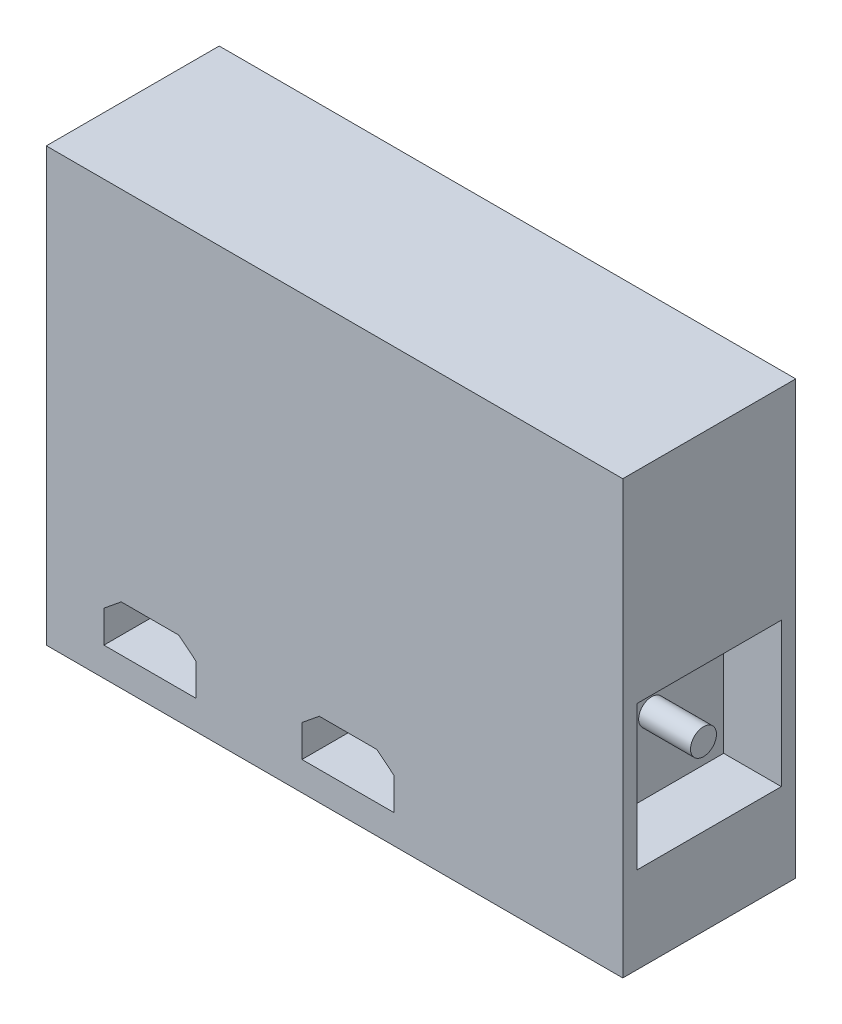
SolidWorks part; units mm, degrees
ref_plane "Front" through (0, 0, 0) normal (0, 0, 1) x (1, 0, 0)
ref_plane "Top" through (0, 0, 0) normal (0, 1, 0) x (1, 0, 0)
ref_plane "Right" through (0, 0, 0) normal (1, 0, 0) x (0, 0, -1)
sketch "Sketch1" plane through (0, 0, 0) normal (0, 0, 1) x (1, 0, 0)
  line L0 (-50, 37.5) -> (50, 37.5)
  line L1 (-50, 37.5) -> (-50, -37.5)
  line L2 (50, -37.5) -> (-50, -37.5)
  line L3 (50, -37.5) -> (50, 37.5)
  line L4 (-50, 37.5) -> (50, -37.5) construction
  line L5 (50, 37.5) -> (-50, -37.5) construction
  point P4 (0, 0)
  dimension "D1" = 100
  dimension "D2" = 75
extrude "Base-Extrude" add sketch "Sketch1" along normal blind 30
sketch "Sketch2" plane through (0, 0, 30) normal (0, 0, 1) x (1, 0, 0)
  line L0 (50, -37.5) -> (-50, -37.5) construction
  line L1 (-40, -26.9426) -> (-40, -32.5)
  line L2 (-24, -32.5) -> (-40, -32.5)
  line L3 (-24, -32.5) -> (-24, -26.9426)
  line L4 (-40, -26.9426) -> (-37, -24.5)
  line L5 (-37, -24.5) -> (-27, -24.5)
  line L6 (-27, -24.5) -> (-24, -26.9426)
  line L7 (-32, -30.7805) -> (-32, -46.1182) construction
  line L8 (-14.8237, -30.7805) -> (-14.8237, -46.1182) construction
  line L9 (-2.6475, -24.5) -> (-5.6475, -26.9426)
  line L10 (7.3525, -24.5) -> (-2.6475, -24.5)
  line L11 (10.3525, -26.9426) -> (7.3525, -24.5)
  line L12 (-5.6475, -32.5) -> (-5.6475, -26.9426)
  line L13 (-5.6475, -32.5) -> (10.3525, -32.5)
  line L14 (10.3525, -26.9426) -> (10.3525, -32.5)
  line L15 (-50, 37.5) -> (-50, -37.5) construction
  dimension "D1" = 5
  dimension "D2" = 10
  dimension "D3" = 10
  dimension "D4" = 8
  dimension "D5" = 3
extrude "Cut-Extrude1" cut sketch "Sketch2" against normal blind 20
sketch "Sketch4" plane through (0, 0, 0) normal (0, 0, -1) x (-1, 0, 0)
  line L4 (50, -37.5) -> (50, 37.5)
  line L5 (50, -37.5) -> (50, 37.5)
  line L6 (50, 37.5) -> (-50, 37.5)
  line L7 (50, 37.5) -> (-50, 37.5)
  line L8 (-50, 37.5) -> (-50, -37.5)
  line L9 (-50, 37.5) -> (-50, -37.5)
  line L10 (-50, -37.5) -> (50, -37.5)
  line L11 (-50, -37.5) -> (50, -37.5)
  dimension "D1" = 0
sketch "Sketch6" plane through (50, 6.6613, 56.8034) normal (1, 0, 0) x (0, 0, -1)
  line L0 (29.3034, -4.1613) -> (54.3034, -4.1613)
  line L1 (29.3034, -4.1613) -> (29.3034, -29.1613)
  line L2 (54.3034, -29.1613) -> (29.3034, -29.1613)
  line L3 (54.3034, -29.1613) -> (54.3034, -4.1613)
  line L4 (41.8034, 30.8387) -> (41.8034, 14.4133) construction
  line L5 (26.8034, 30.8387) -> (56.8034, 30.8387) construction
  line L6 (29.3034, -4.1613) -> (54.3034, -29.1613) construction
  line L7 (54.3034, -4.1613) -> (29.3034, -29.1613) construction
  line L8 (26.8034, -44.1613) -> (56.8034, -44.1613) construction
  circle A0 centre (41.8034, -16.6613) radius 2.25
  dimension "D5" = 4.5
  dimension "D1" = 25
  dimension "D2" = 25
  dimension "D3" = 15
extrude "Cut-Extrude4" cut sketch "Sketch6" against normal blind 10
sketch "Sketch7" plane through (50, 0, 0) normal (1, 0, 0) x (0, 0, -1)
  circle A1 centre (-15, -10) radius 2.25
  circle A2 centre (-15, -10) radius 2.25
  dimension "D1" = 0
extrude "Cut-Extrude5" cut sketch "Sketch7" against normal blind 1
